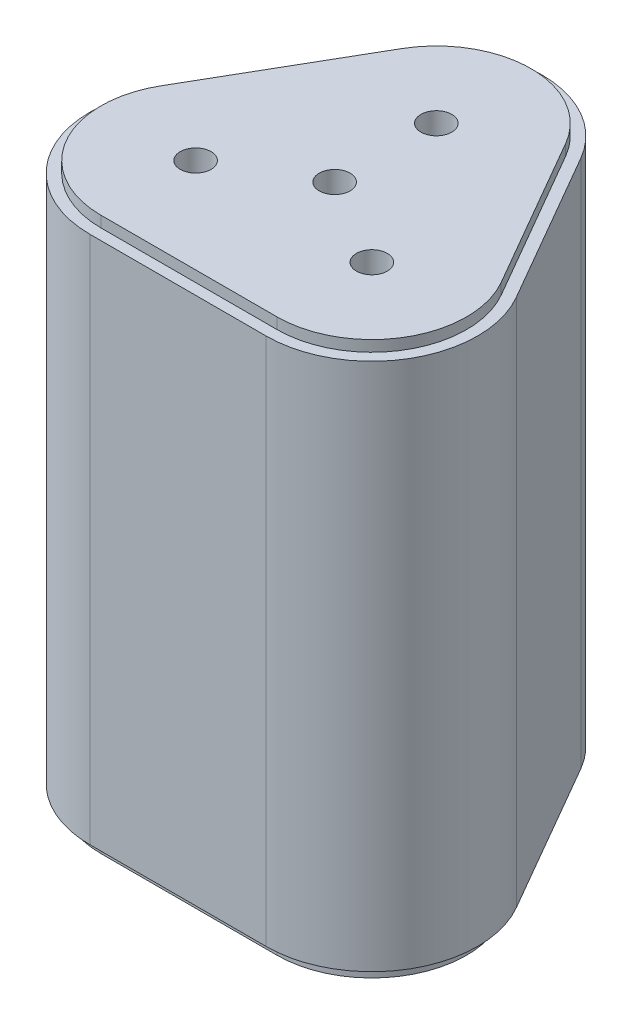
SolidWorks part; units mm, degrees
ref_plane "Спереди" through (0, 0, 0) normal (0, 0, 1) x (1, 0, 0)
ref_plane "Сверху" through (0, 0, 0) normal (0, 1, 0) x (1, 0, 0)
ref_plane "Справа" through (0, 0, 0) normal (1, 0, 0) x (0, 0, -1)
sketch "Эскиз1" plane through (0, 0, 0) normal (0, 1, 0) x (1, 0, 0)
  line L0 (0, 0) -> (0, 11.547) construction
  line L1 (0, 0) -> (10, -5.7735) construction
  line L2 (0, 0) -> (-10, -5.7735) construction
  line L3 (10.3923, 17.547) -> (20.3923, 0.2265)
  line L4 (10, -17.7735) -> (-10, -17.7735)
  line L5 (-10.3923, 17.547) -> (-20.3923, 0.2265)
  arc A0 (-10.3923, 17.547) -> (10.3923, 17.547) centre (0, 11.547) cw
  arc A1 (20.3923, 0.2265) -> (10, -17.7735) centre (10, -5.7735) cw
  arc A2 (-20.3923, 0.2265) -> (-10, -17.7735) centre (-10, -5.7735) ccw
  dimension "D1" = 12
  dimension "D5" = 41.3205
  dimension "D6" = 44
  dimension "D2" = 120
  dimension "D3" = 120
  dimension "D4" = 20
extrude "Бобышка-Вытянуть1" add sketch "Эскиз1" along normal blind 60
sketch "Эскиз2" plane through (0, 0, 0) normal (0, -1, 0) x (1, 0, 0)
  line L0 (-10, 15.2735) -> (10, 15.2735)
  line L1 (18.2272, 1.0235) -> (8.2272, -16.297)
  line L2 (-18.2272, 1.0235) -> (-8.2272, -16.297)
  arc A0 (18.2272, 1.0235) -> (10, 15.2735) centre (10, 5.7735) ccw
  arc A1 (-10, 15.2735) -> (-18.2272, 1.0235) centre (-10, 5.7735) ccw
  arc A2 (-8.2272, -16.297) -> (8.2272, -16.297) centre (0, -11.547) ccw
  arc A3 (20.3923, -0.2265) -> (10, 17.7735) centre (10, 5.7735) ccw construction
  arc A4 (-10, 17.7735) -> (-20.3923, -0.2265) centre (-10, 5.7735) ccw construction
  arc A5 (-10.3923, -17.547) -> (10.3923, -17.547) centre (0, -11.547) ccw construction
  dimension "D1" = 19
extrude "Вырез-Вытянуть1" cut sketch "Эскиз2" against normal offset from surface (57 mm away) 3
sketch "Эскиз3" plane through (0, 0, 0) normal (0, -1, 0) x (1, 0, 0)
  line L3 (-18.2272, 1.0235) -> (-8.2272, -16.297) construction
  line L4 (10, 15.2735) -> (-10, 15.2735) construction
  line L5 (8.2272, -16.297) -> (18.2272, 1.0235) construction
  line L6 (9.3098, -16.922) -> (19.3098, 0.3985)
  line L7 (-19.3098, 0.3985) -> (-9.3098, -16.922)
  line L8 (10, 16.5235) -> (-10, 16.5235)
  line L9 (9.3098, -16.922) -> (19.3098, 0.3985)
  line L10 (-19.3098, 0.3985) -> (-9.3098, -16.922)
  line L11 (10, 16.5235) -> (-10, 16.5235)
  line L12 (-18.2272, 1.0235) -> (-8.2272, -16.297)
  line L13 (10, 15.2735) -> (-10, 15.2735)
  line L14 (8.2272, -16.297) -> (18.2272, 1.0235)
  arc A3 (-8.2272, -16.297) -> (8.2272, -16.297) centre (0, -11.547) ccw construction
  arc A4 (-10, 15.2735) -> (-18.2272, 1.0235) centre (-10, 5.7735) ccw construction
  arc A5 (18.2272, 1.0235) -> (10, 15.2735) centre (10, 5.7735) ccw construction
  arc A6 (-9.3098, -16.922) -> (9.3098, -16.922) centre (0, -11.547) ccw
  arc A7 (-10, 16.5235) -> (-19.3098, 0.3985) centre (-10, 5.7735) ccw
  arc A8 (19.3098, 0.3985) -> (10, 16.5235) centre (10, 5.7735) ccw
  arc A9 (-9.3098, -16.922) -> (9.3098, -16.922) centre (0, -11.547) ccw
  arc A10 (-10, 16.5235) -> (-19.3098, 0.3985) centre (-10, 5.7735) ccw
  arc A11 (19.3098, 0.3985) -> (10, 16.5235) centre (10, 5.7735) ccw
  arc A12 (-8.2272, -16.297) -> (8.2272, -16.297) centre (0, -11.547) ccw
  arc A13 (-10, 15.2735) -> (-18.2272, 1.0235) centre (-10, 5.7735) ccw
  arc A14 (18.2272, 1.0235) -> (10, 15.2735) centre (10, 5.7735) ccw
  dimension "D1" = 1.25
extrude "Бобышка-Вытянуть2" add sketch "Эскиз3" along normal blind 1.5
sketch "Эскиз7" plane through (0, 60, 0) normal (0, 1, 0) x (1, 0, 0)
  line L9 (-9.3098, 16.922) -> (-19.3098, -0.3985)
  line L10 (-10, -16.5235) -> (10, -16.5235)
  line L11 (19.3098, -0.3985) -> (9.3098, 16.922)
  line L12 (-9.3098, 16.922) -> (-19.3098, -0.3985)
  line L13 (-10, -16.5235) -> (10, -16.5235)
  line L14 (19.3098, -0.3985) -> (9.3098, 16.922)
  arc A9 (-19.3098, -0.3985) -> (-10, -16.5235) centre (-10, -5.7735) ccw
  arc A10 (10, -16.5235) -> (19.3098, -0.3985) centre (10, -5.7735) ccw
  arc A11 (9.3098, 16.922) -> (-9.3098, 16.922) centre (0, 11.547) ccw
  arc A12 (-19.3098, -0.3985) -> (-10, -16.5235) centre (-10, -5.7735) ccw
  arc A13 (10, -16.5235) -> (19.3098, -0.3985) centre (10, -5.7735) ccw
  arc A14 (9.3098, 16.922) -> (-9.3098, 16.922) centre (0, 11.547) ccw
  dimension "D1" = 1.25
extrude "Бобышка-Вытянуть3" add sketch "Эскиз7" along normal blind 1.25
sketch "Эскиз8" plane through (0, 57, 0) normal (0, -1, 0) x (1, 0, 0)
  circle A0 centre (0, 0) radius 1.75
  dimension "D1" = 3.5
extrude "Вырез-Вытянуть2" cut sketch "Эскиз8" against normal through all
sketch "Эскиз9" plane through (0, 57, 0) normal (0, -1, 0) x (1, 0, 0)
  circle A0 centre (10, 5.7735) radius 1.75
  circle A1 centre (-10, 5.7735) radius 1.75
  circle A2 centre (0, -11.547) radius 1.75
  arc A3 (-10, 15.2735) -> (-18.2272, 1.0235) centre (-10, 5.7735) ccw construction
  arc A4 (18.2272, 1.0235) -> (10, 15.2735) centre (10, 5.7735) ccw construction
  arc A5 (-8.2272, -16.297) -> (8.2272, -16.297) centre (0, -11.547) ccw construction
  dimension "D1" = 3.5
extrude "Вырез-Вытянуть3" cut sketch "Эскиз9" against normal through all
